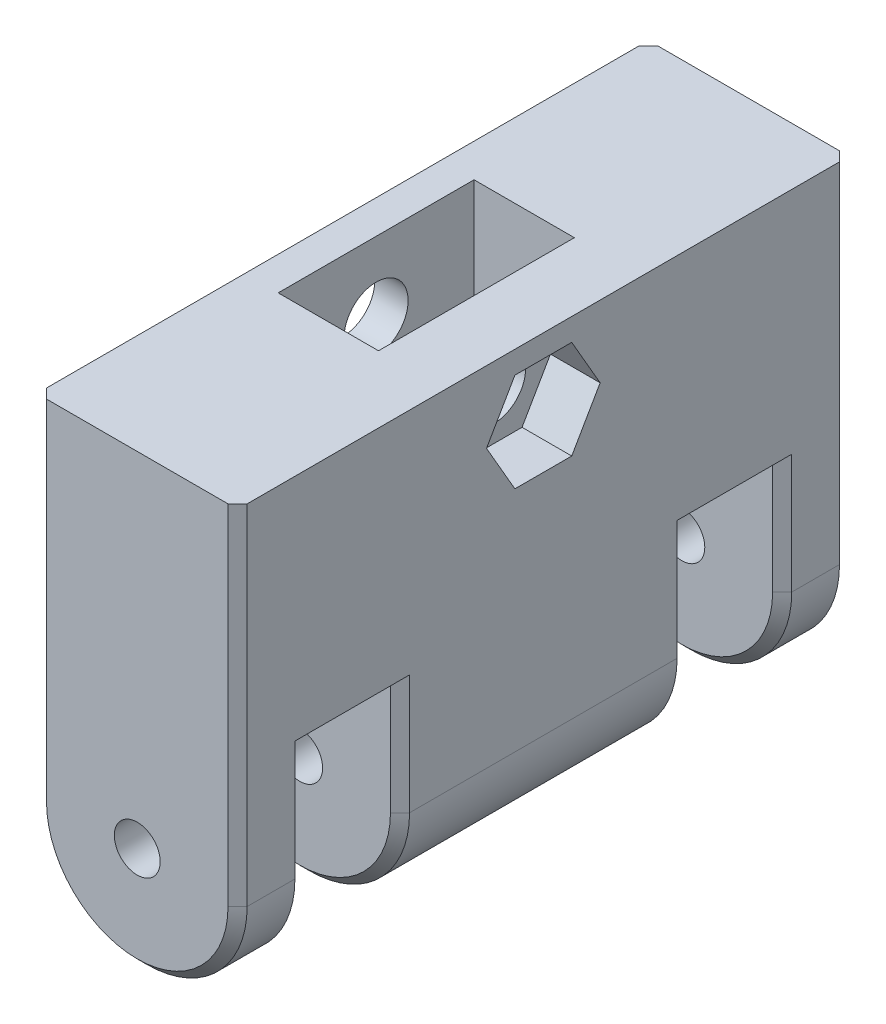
SolidWorks part; units mm, degrees
ref_plane "Front Plane" through (0, 0, 0) normal (0, 0, 1) x (1, 0, 0)
ref_plane "Top Plane" through (0, 0, 0) normal (0, 1, 0) x (1, 0, 0)
ref_plane "Right Plane" through (0, 0, 0) normal (1, 0, 0) x (0, 0, -1)
sketch "Sketch2" plane through (0, 0, 0) normal (0, 0, 1) x (1, 0, 0)
  line L1 (-21, 25) -> (0, 25)
  line L2 (-21, 25) -> (-21, 0)
  line L3 (-21, 0) -> (0, 0)
  line L4 (0, 25) -> (0, 0)
  dimension "D1" = 25
  dimension "D2" = 21
extrude "Boss-Extrude1" add sketch "Sketch2" along normal mid plane 64
sketch "Sketch3" plane through (0, 25, 0) normal (0, 1, 0) x (1, 0, 0)
  line L1 (-17.5, 10.25) -> (-7, 10.25)
  line L2 (-17.5, 10.25) -> (-17.5, -10.25)
  line L3 (-17.5, -10.25) -> (-7, -10.25)
  line L4 (-7, 10.25) -> (-7, -10.25)
  point P4 (-7, 0)
  dimension "D1" = 10.5
  dimension "D2" = 20.5
  dimension "D3" = 7
extrude "Cut-Extrude1" cut sketch "Sketch3" against normal blind 18.5
sketch "Sketch4" plane through (-21, 0, 0) normal (-1, 0, 0) x (0, 0, 1)
  line L0 (32, 25) -> (-32, 25) construction
  circle A0 centre (0, 17.5) radius 3.35
  point P5 (0, 25)
  dimension "D2" = 6.7
  dimension "D1" = 7.5
extrude "Cut-Extrude2" cut sketch "Sketch4" against normal through all both and the other way through all
sketch "Sketch5" plane through (0, 0, 0) normal (1, 0, 0) x (0, 0, -1)
  line L1 (2.9734, 22.65) -> (-2.9734, 22.65)
  line L2 (-2.9734, 22.65) -> (-5.9467, 17.5)
  line L3 (-5.9467, 17.5) -> (-2.9734, 12.35)
  line L4 (-2.9734, 12.35) -> (2.9734, 12.35)
  line L5 (2.9734, 12.35) -> (5.9467, 17.5)
  line L6 (5.9467, 17.5) -> (2.9734, 22.65)
  circle A0 centre (0, 17.5) radius 5.15 construction
  dimension "D1" = 10.3
extrude "Cut-Extrude3" cut sketch "Sketch5" against normal blind 5.2
sketch "Sketch6" plane through (0, 0, 0) normal (0, -1, 0) x (1, 0, 0)
  line L0 (-21, 32) -> (-21, -32) construction
  line L5 (-21, 15) -> (0, 15)
  line L10 (-21, 15) -> (-21, -15)
  line L11 (0, 32) -> (0, -32) construction
  line L12 (-21, 32) -> (0, 32)
  line L13 (-21, 32) -> (-21, 25)
  line L14 (-21, 25) -> (0, 25)
  line L15 (0, 32) -> (0, 25)
  line L25 (11.55, 0) -> (-11.55, 0) construction
  line L30 (-21, -25) -> (0, -25)
  line L31 (0, -32) -> (0, -25)
  line L32 (-21, -32) -> (0, -32)
  line L33 (-21, -32) -> (-21, -25)
  line L34 (-21, -15) -> (0, -15)
  line L35 (0, 15) -> (0, -15)
  point P14 (0, 0)
  dimension "D1" = 10
  dimension "D2" = 7
extrude "Boss-Extrude2" add sketch "Sketch6" along normal blind 22
sketch "Sketch7" plane through (0, 0, -25) normal (0, 0, 1) x (1, 0, 0)
  line L0 (0, -22) -> (0, 0) construction
  line L1 (0, 0) -> (-21, 0) construction
  circle A0 centre (-10.5, -11) radius 2.4
  point P4 (0, -11)
  point P7 (-10.5, 0)
  dimension "D1" = 4.8
extrude "Cut-Extrude4" cut sketch "Sketch7" against normal through all both and the other way through all
fillet "Fillet1" radius 10.5 6 edges at (0, -22, -28.5) (-21, -22, -28.5) (-21, -22, 28.5) (0, -22, 28.5) (0, -22, 0) (-21, -22, 0)
chamfer "Chamfer1" distance 1 angle 45 28 edges at (-21, -5.75, -25) (-17.9246, -18.9246, -25) (-3.0754, -18.9246, -25) (0, -5.75, -25) (0, 0, -20) (0, 0, 20) (0, -5.75, -15) (-3.0754, -18.9246, -15) (-17.9246, -18.9246, -15) (-21, 0, -20) (-21, -5.75, -15) (0, -5.75, 15) (0, -5.75, 25) (-3.0754, -18.9246, 15) (-3.0754, -18.9246, 25) (-17.9246, -18.9246, 15) (-17.9246, -18.9246, 25) (-21, -5.75, 15) (-21, 0, 20) (-21, -5.75, 25) (0, 6.75, -32) (-3.0754, -18.9246, -32) (-17.9246, -18.9246, -32) (-21, 6.75, -32) (0, 6.75, 32) (-3.0754, -18.9246, 32) (-17.9246, -18.9246, 32) (-21, 6.75, 32)
